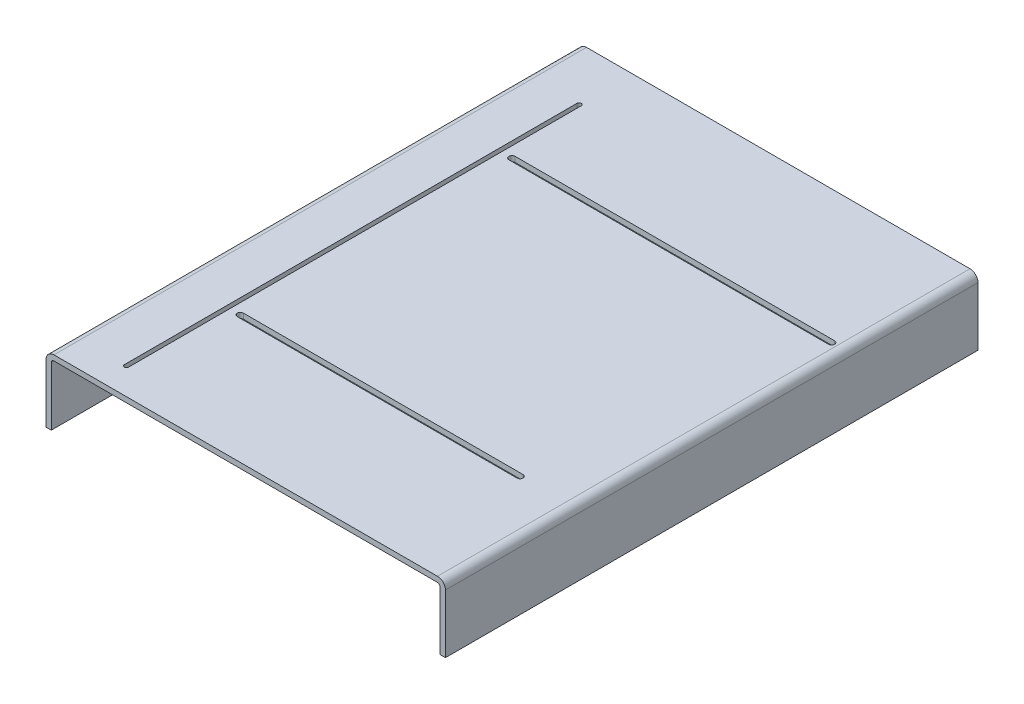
SolidWorks part; units mm, degrees
ref_plane "Ebene vorne" through (0, 0, 0) normal (0, 0, 1) x (1, 0, 0)
ref_plane "Ebene oben" through (0, 0, 0) normal (0, 1, 0) x (1, 0, 0)
ref_plane "Ebene rechts" through (0, 0, 0) normal (1, 0, 0) x (0, 0, -1)
sketch "Skizze1" plane through (0, 0, 0) normal (0, 0, 1) x (1, 0, 0)
  line L0 (0, 0) -> (0, 125)
  line L1 (0, 125) -> (750, 125)
  line L2 (750, 125) -> (750, 0)
  line L3 (10, 0) -> (10, 115)
  line L4 (10, 115) -> (740, 115)
  line L5 (740, 115) -> (740, 0)
  line L6 (740, 0) -> (750, 0)
  line L7 (10, 0) -> (0, 0)
  dimension "D1" = 750
  dimension "D2" = 125
  dimension "D4" = 125
  dimension "D3" = 10
extrude "Aufsatz-Linear austragen1" add sketch "Skizze1" along normal blind 1000
fillet "Verrundung1" radius 5 2 edges at (740, 115, 500) (10, 115, 500)
fillet "Verrundung2" radius 15 2 edges at (0, 125, 500) (750, 125, 500)
sketch "Skizze3" plane through (0, 125, 0) normal (0, 1, 0) x (1, 0, 0)
  line L3 (0, -1000) -> (0, 0) construction
  line L5 (735, 0) -> (15, 0) construction
  line L8 (125, -250) -> (725, -250) construction
  line L9 (125, -255.75) -> (725, -255.75)
  line L10 (125, -244.25) -> (725, -244.25)
  arc A2 (125, -255.75) -> (125, -244.25) centre (125, -250) cw
  arc A3 (725, -244.25) -> (725, -255.75) centre (725, -250) cw
  point P19 (425, -250)
  dimension "D1" = 250
  dimension "D4" = 250
  dimension "D5" = 600
  dimension "D6" = 11.5
  dimension "D8" = 125
extrude "Schnitt-Linear austragen1" cut sketch "Skizze3" against normal up to surface (10 mm away)
sketch "Skizze4" plane through (0, 125, 0) normal (0, 1, 0) x (1, 0, 0)
  line L0 (101, -100) -> (101, -950) construction
  line L1 (105, -100) -> (105, -950)
  line L2 (97, -100) -> (97, -950)
  line L3 (0, -1000) -> (0, 0) construction
  line L4 (735, 0) -> (15, 0) construction
  line L5 (735, -1000) -> (15, -1000) construction
  arc A0 (105, -100) -> (97, -100) centre (101, -100) ccw
  arc A1 (97, -950) -> (105, -950) centre (101, -950) ccw
  point P2 (101, -525)
  dimension "D1" = 101
  dimension "D2" = 8
  dimension "D3" = 100
  dimension "D4" = 50
extrude "Schnitt-Linear austragen2" cut sketch "Skizze4" against normal through all
sketch "Skizze8" plane through (0, 125, 0) normal (0, 1, 0) x (1, 0, 0)
  line L0 (125, -760) -> (650, -760) construction
  line L1 (125, -754.25) -> (650, -754.25)
  line L2 (125, -765.75) -> (650, -765.75)
  line L3 (735, -1000) -> (15, -1000) construction
  line L4 (0, -1000) -> (0, 0) construction
  arc A0 (125, -754.25) -> (125, -765.75) centre (125, -760) ccw
  arc A1 (650, -765.75) -> (650, -754.25) centre (650, -760) ccw
  point P2 (387.5, -760)
  dimension "D1" = 525
  dimension "D2" = 240
  dimension "D3" = 11.5
  dimension "D4" = 125
extrude "Schnitt-Linear austragen4" cut sketch "Skizze8" against normal up to next
sketch "Skizze9" plane through (0, 125, 0) normal (0, 1, 0) x (1, 0, 0)
  line L0 (145, -250) -> (650, -250) construction
  line L1 (125, -255.75) -> (725, -255.75) construction
  line L2 (140, -760) -> (635, -760) construction
  line L3 (125, -765.75) -> (650, -765.75) construction
  arc A0 (725, -255.75) -> (725, -244.25) centre (725, -250) ccw construction
  arc A1 (125, -244.25) -> (125, -255.75) centre (125, -250) ccw construction
  arc A2 (650, -765.75) -> (650, -754.25) centre (650, -760) ccw construction
  arc A3 (125, -754.25) -> (125, -765.75) centre (125, -760) ccw construction
  spline S0 degree 1 poles (140, -760) (635, -760) knots 0 0 1 1
  spline S1 degree 1 poles (145, -250) (650, -250) knots 0 0 1 1
  dimension "D2" = 75
  dimension "D3" = 20
  dimension "D5" = 15
  dimension "D6" = 15
  dimension "D1" = 5.75
  dimension "D4" = 5.75
  dimension "Dicke" = 6
